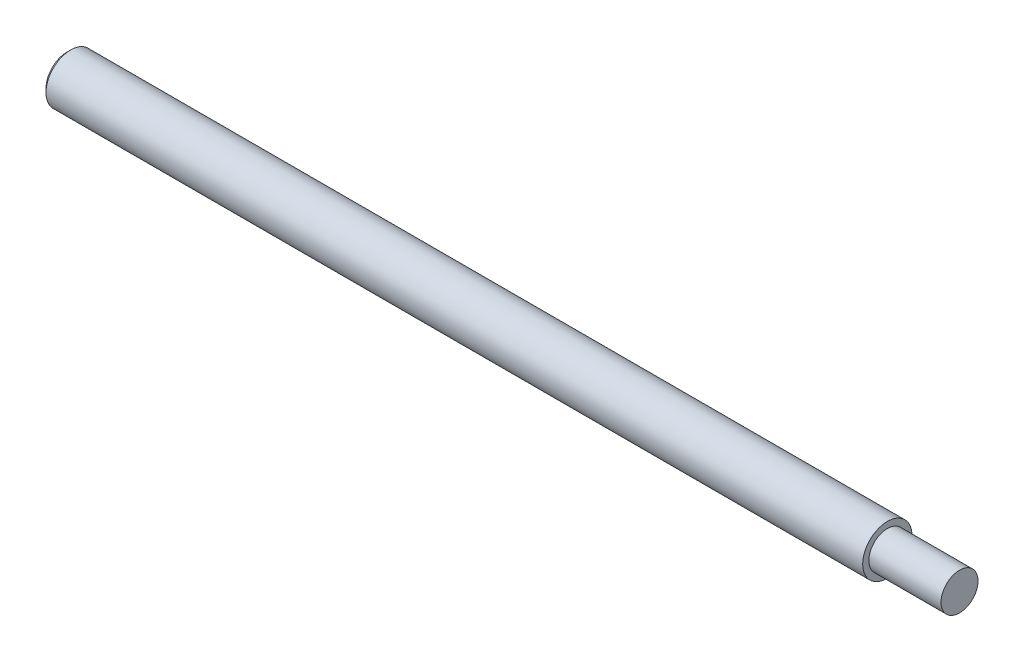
SolidWorks part; units mm, degrees
ref_plane "Face" through (0, 0, 0) normal (0, 0, 1) x (1, 0, 0)
ref_plane "Dessus" through (0, 0, 0) normal (0, 1, 0) x (1, 0, 0)
ref_plane "Droite" through (0, 0, 0) normal (1, 0, 0) x (0, 0, -1)
sketch "Esquisse1" plane through (0, 0, 0) normal (0, 0, 1) x (1, 0, 0)
  line L0 (0, 0) -> (104.553, 0) construction
  line L1 (0, 0) -> (0, 20)
  line L2 (0, 20) -> (665, 20)
  line L3 (665, 20) -> (665, 15)
  line L4 (665, 15) -> (723.5, 15)
  line L5 (723.5, 15) -> (723.5, 0)
  line L6 (0, 0) -> (723.5, 0)
  dimension "D1" = 40
  dimension "D2" = 30
  dimension "D3" = 58.5
  dimension "D4" = 665
revolve "Révolution1" add sketch "Esquisse1" angle 360 about L0
chamfer "Chanfrein1" distance 3 angle 45 1 edges at (0, 0, 20)
